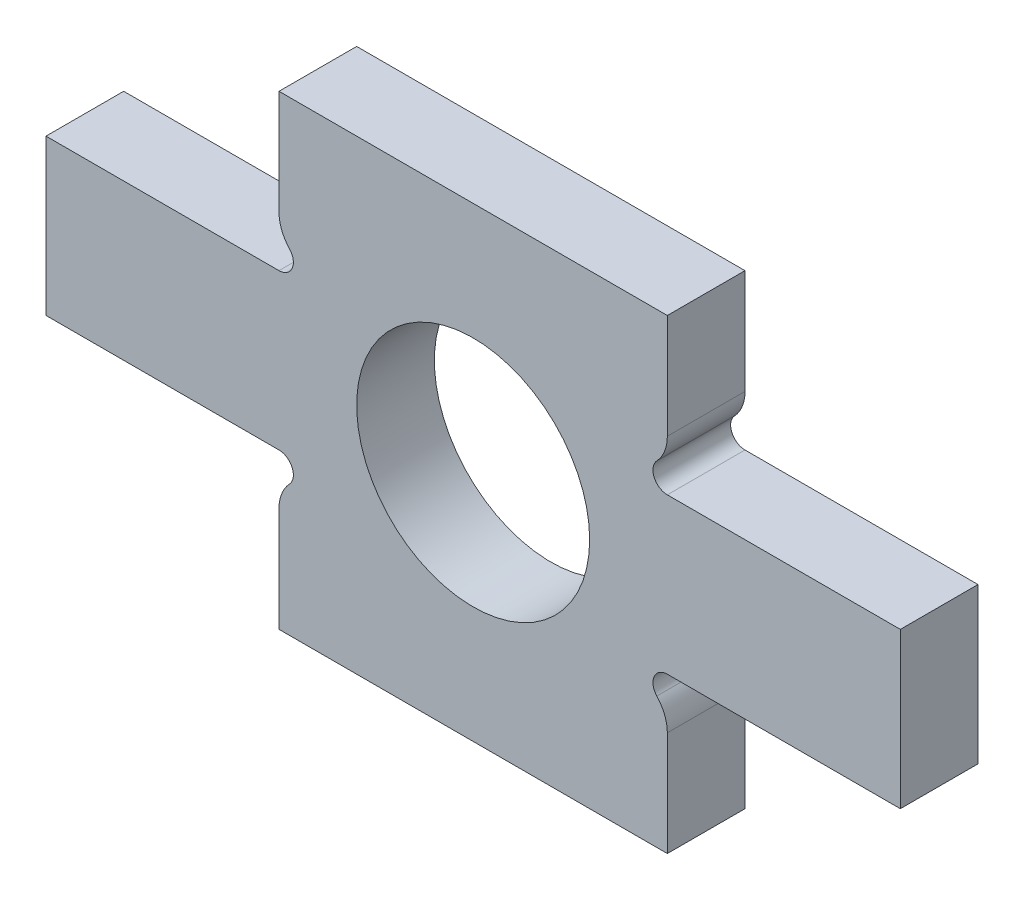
SolidWorks part; units mm, degrees
ref_plane "Plan de face" through (0, 0, 0) normal (0, 0, 1) x (1, 0, 0)
ref_plane "Plan de dessus" through (0, 0, 0) normal (0, 1, 0) x (1, 0, 0)
ref_plane "Plan de droite" through (0, 0, 0) normal (1, 0, 0) x (0, 0, -1)
sketch "Esquisse1" plane through (0, 0, 0) normal (0, 0, 1) x (1, 0, 0)
  line L7 (25, -10) -> (55, -10)
  line L8 (55, -10) -> (55, 10)
  line L9 (55, 10) -> (25, 10)
  line L10 (25, 16.5321) -> (25, 30)
  line L11 (25, 30) -> (-25, 30)
  line L12 (-25, 30) -> (-25, 16.5321)
  line L13 (-25, 10) -> (-55, 10)
  line L14 (-55, 10) -> (-55, -10)
  line L15 (-55, -10) -> (-25, -10)
  line L16 (-25, -16.5321) -> (-25, -30)
  line L17 (-25, -30) -> (25, -30)
  line L18 (25, -30) -> (25, -16.5321)
  arc A0 (25, -16.5321) -> (23.6496, -13.1145) centre (20, -16.5321) ccw
  arc A1 (25, -10) -> (23.6496, -13.1145) centre (25, -11.85) ccw
  arc A2 (23.6496, 13.1145) -> (25, 10) centre (25, 11.85) ccw
  arc A3 (23.6496, 13.1145) -> (25, 16.5321) centre (20, 16.5321) ccw
  arc A4 (-25, 16.5321) -> (-23.6496, 13.1145) centre (-20, 16.5321) ccw
  arc A5 (-25, 10) -> (-23.6496, 13.1145) centre (-25, 11.85) ccw
  arc A6 (-23.6496, -13.1145) -> (-25, -10) centre (-25, -11.85) ccw
  arc A7 (-23.6496, -13.1145) -> (-25, -16.5321) centre (-20, -16.5321) ccw
  dimension "D1" = 5
  dimension "D2" = 1.85
  dimension "D3" = 60
  dimension "D4" = 25
  dimension "D5" = 50
  dimension "D6" = 55
extrude "Boss.-Extru.1" add sketch "Esquisse1" along normal blind 10
sketch "Esquisse3" plane through (0, 0, 10) normal (0, 0, 1) x (1, 0, 0)
  circle A0 centre (0, 0) radius 15
  dimension "D1" = 30
extrude "Enlèv. mat.-Extru.1" cut sketch "Esquisse3" against normal through all
